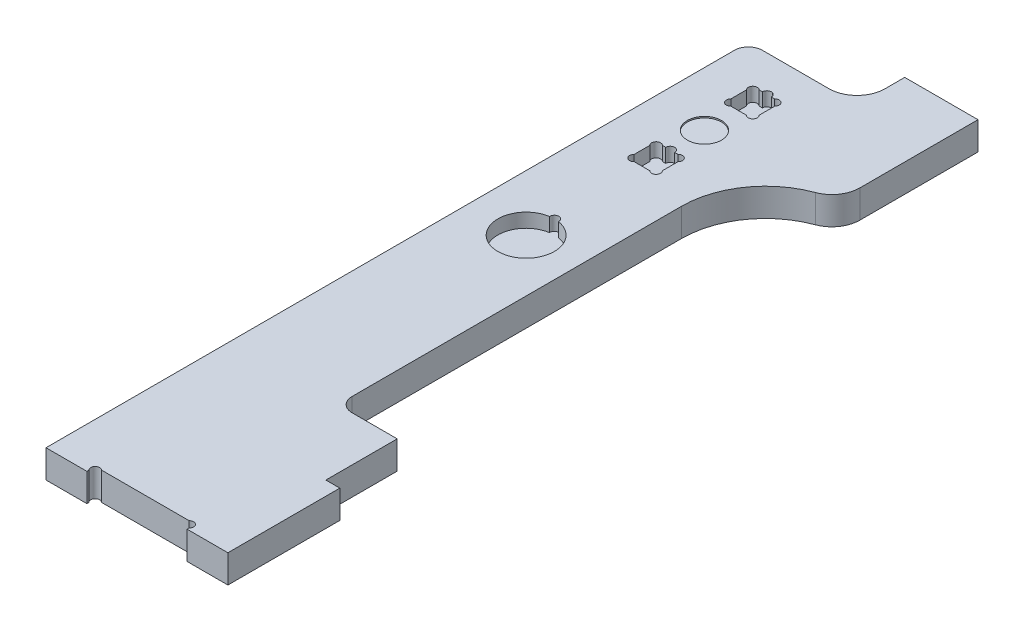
SolidWorks part; units mm, degrees
ref_plane "Plan de face" through (0, 0, 0) normal (0, 0, 1) x (1, 0, 0)
ref_plane "Plan de dessus" through (0, 0, 0) normal (0, 1, 0) x (1, 0, 0)
ref_plane "Plan de droite" through (0, 0, 0) normal (1, 0, 0) x (0, 0, -1)
sketch "Esquisse1" plane through (0, 0, 0) normal (0, 1, 0) x (1, 0, 0)
  line L1 (-32.5, 133) -> (32.5, 133)
  line L2 (-32.5, 133) -> (-32.5, -133)
  line L3 (-32.5, -133) -> (32.5, -133)
  line L4 (32.5, 133) -> (32.5, -133)
  line L5 (-32.5, 133) -> (32.5, -133) construction
  line L6 (-32.5, -133) -> (32.5, 133) construction
  point P0 (0, 0)
extrude "Boss.-Extru.1" add sketch "Esquisse1" along normal blind 10 contours L2 L3 L4 L1
sketch "Esquisse2" plane through (0, 10, 0) normal (0, 1, 0) x (1, 0, 0)
  arc A0 (-10.905, 28.5333) -> (-14.095, 28.5333) centre (-12.5, 28.66) ccw
  arc A1 (-14.095, 28.5333) -> (-10.905, 28.5333) centre (-12.5, 18.56) ccw
extrude "Enlèv. mat.-Extru.1" cut sketch "Esquisse2" against normal through all
sketch "Esquisse3" plane through (0, 10, 0) normal (0, 1, 0) x (1, 0, 0)
  line L1 (32.5, 133) -> (32.5, -133) construction
  line L2 (32.5, 93) -> (27.5, 93)
  line L3 (32.5, 93) -> (32.5, -93)
  line L4 (32.5, -93) -> (27.5, -93)
  line L5 (27.5, 93) -> (27.5, -93)
  line L6 (-32.5, 133) -> (32.5, 133) construction
  line L7 (-32.5, -133) -> (32.5, -133) construction
  dimension "D1" = 40
  dimension "D2" = 40
  dimension "D3" = 5
extrude "Enlèv. mat.-Extru.2" cut sketch "Esquisse3" against normal through all
sketch "Esquisse6" plane through (0, 0, 0) normal (0, -1, 0) x (1, 0, 0)
  line L1 (-10.2548, -105.1519) -> (-11.4421, -105.1519)
  line L2 (-7.9921, -102.8891) -> (-7.9921, -97.3146)
  line L3 (-10.2548, -95.0519) -> (-15.8293, -95.0519)
  line L4 (-18.0921, -102.8891) -> (-18.0921, -97.3146)
  line L5 (-10.3548, -70.7019) -> (-11.5422, -70.7019)
  line L6 (-8.0921, -68.4391) -> (-8.0921, -62.8646)
  line L7 (-10.3548, -60.6019) -> (-15.9296, -60.6019)
  line L8 (-18.1923, -68.4391) -> (-18.1923, -62.8646)
  line L10 (-32.5, -133) -> (32.5, -133) construction
  line L11 (-13.0421, -105.1519) -> (-13.0421, -56.3193) construction
  line L12 (-18.0921, -100.1019) -> (1.8433, -100.1019) construction
  line L13 (-18.1923, -70.7019) -> (-14.7424, -67.2519) construction
  line L14 (-18.0921, -105.1519) -> (-15.1112, -102.171) construction
  line L15 (-8.0921, -65.6519) -> (-19.541, -65.6519) construction
  line L16 (-13.1422, -60.6019) -> (-13.1422, -71.7825) construction
  line L17 (-14.6421, -105.1519) -> (-15.8293, -105.1519)
  line L19 (-14.7422, -70.7019) -> (-15.9296, -70.7019)
  arc A0 (-18.0921, -102.8891) -> (-15.8293, -105.1519) centre (-16.9607, -104.0205) ccw
  arc A1 (-7.9921, -102.8891) -> (-10.2548, -105.1519) centre (-9.1234, -104.0205) cw
  arc A2 (-7.9921, -97.3146) -> (-10.2548, -95.0519) centre (-9.1234, -96.1832) ccw
  arc A3 (-18.0921, -97.3146) -> (-15.8293, -95.0519) centre (-16.9607, -96.1832) cw
  arc A4 (-15.9296, -70.7019) -> (-18.1923, -68.4391) centre (-17.061, -69.5705) cw
  arc A5 (-10.3548, -70.7019) -> (-8.0921, -68.4391) centre (-9.2234, -69.5705) ccw
  arc A6 (-10.3548, -60.6019) -> (-8.0921, -62.8646) centre (-9.2234, -61.7332) cw
  arc A7 (-15.9296, -60.6019) -> (-18.1923, -62.8646) centre (-17.061, -61.7332) ccw
  arc A8 (-14.6421, -105.1519) -> (-11.4421, -105.1519) centre (-13.0421, -105.1519) ccw
  arc A9 (-14.7422, -70.7019) -> (-11.5422, -70.7019) centre (-13.1422, -70.7019) ccw
  point P1 (-17.061, -69.5705)
  point P20 (-16.9607, -104.0205)
  dimension "D5" = 45
  dimension "D6" = 1.6
  dimension "D7" = 27.8481
  dimension "D8" = 62.2981
  dimension "D10" = 45
  dimension "D11" = 1.6
extrude "Enlèv. mat.-Extru.5" cut sketch "Esquisse6" against normal through all
sketch "Esquisse7" plane through (0, 10, 0) normal (0, 1, 0) x (1, 0, 0)
  line L0 (-7.9921, 102.8891) -> (-7.9921, 97.3146) construction
  line L1 (6.3179, 133) -> (32.5, 133)
  line L2 (6.3179, 133) -> (6.3179, -67.4993)
  line L3 (6.3179, -67.4993) -> (32.5, -67.4993)
  line L4 (32.5, 133) -> (32.5, -67.4993)
  line L5 (-32.5, 133) -> (32.5, 133) construction
  line L6 (32.5, 133) -> (32.5, 93) construction
  dimension "D1" = 14.31
  dimension "D2" = 0
  dimension "D3" = 0
  dimension "D4" = 200.4993
extrude "Enlèv. mat.-Extru.6" cut sketch "Esquisse7" against normal through all
sketch "Esquisse8" plane through (0, 10, 0) normal (0, 1, 0) x (1, 0, 0)
  line L1 (-17.91, -133) -> (17.91, -133)
  line L2 (-17.91, -133) -> (-17.91, -132.2627)
  line L3 (-15.6473, -130) -> (15.6473, -130)
  line L4 (17.91, -133) -> (17.91, -132.2627)
  line L5 (32.5, -93) -> (32.5, -133) construction
  line L6 (-32.5, -133) -> (32.5, -133) construction
  line L7 (0, -143.432) -> (0, -125.9574) construction
  line L8 (17.91, -130) -> (7.3709, -140.5391) construction
  arc A0 (17.91, -132.2627) -> (15.6473, -130) centre (16.7786, -131.1314) ccw
  arc A1 (-17.91, -132.2627) -> (-15.6473, -130) centre (-16.7786, -131.1314) cw
  dimension "D2" = 14.59
  dimension "D3" = 3
  dimension "D4" = 0
  dimension "D5" = 45
extrude "Enlèv. mat.-Extru.7" cut sketch "Esquisse8" against normal through all
sketch "Esquisse9" plane through (0, 0, 0) normal (0, -1, 0) x (1, 0, 0)
  line L1 (-26.9651, -4.9867) -> (0, -4.9867)
  line L2 (-26.9651, -4.9867) -> (-26.9651, -114.3245)
  line L3 (-26.9651, -114.3245) -> (0, -114.3245)
  line L4 (0, -4.9867) -> (0, -114.3245)
extrude "Boss.-Extru.2" add sketch "Esquisse9" against normal blind 5
sketch "Esquisse10" plane through (0, 10, 0) normal (0, 1, 0) x (1, 0, 0)
  line L0 (-13.0421, 95.0519) -> (-13.1422, 70.7019) construction
  line L1 (-15.8293, 95.0519) -> (-10.2548, 95.0519) construction
  circle A0 centre (-13.0921, 82.8769) radius 6.1
extrude "Enlèv. mat.-Extru.8" cut sketch "Esquisse10" against normal blind 0.5
sketch "Esquisse11" plane through (0, 10, 0) normal (0, 1, 0) x (1, 0, 0)
  line L1 (-32.5, 133) -> (7.5, 133)
  line L2 (-32.5, 133) -> (-32.5, 118)
  line L3 (-32.5, 118) -> (7.5, 118)
  line L4 (7.5, 133) -> (7.5, 118)
  dimension "D1" = 15
  dimension "D2" = 40
extrude "Enlèv. mat.-Extru.9" cut sketch "Esquisse11" against normal through all
fillet "Congé3" radius 5 2 edges at (-32.5, 5, -118) (6.3179, 5, 67.4993)
sketch "Esquisse13" plane through (0, 0, 0) normal (0, -1, 0) x (1, 0, 0)
  line L0 (6.3179, -118) -> (6.3179, 62.4993) construction
  line L1 (6.3179, -85.04) -> (32.5, -85.04)
  line L2 (6.3179, -85.04) -> (6.3179, -135.04)
  line L3 (6.3179, -135.04) -> (32.5, -135.04)
  line L4 (32.5, -85.04) -> (32.5, -135.04)
  line L5 (-27.5, -118) -> (6.3179, -118) construction
  line L6 (32.5, 93) -> (32.5, 133) construction
  dimension "D1" = 17.04
  dimension "D2" = 50
  dimension "D3" = 0
extrude "Boss.-Extru.3" add sketch "Esquisse13" against normal blind 10
fillet "Congé4" radius 30 1 edges at (6.3179, 5, -85.04)
fillet "Congé5" radius 10 2 edges at (32.5, 5, -85.04) (6.3179, 5, -118)
